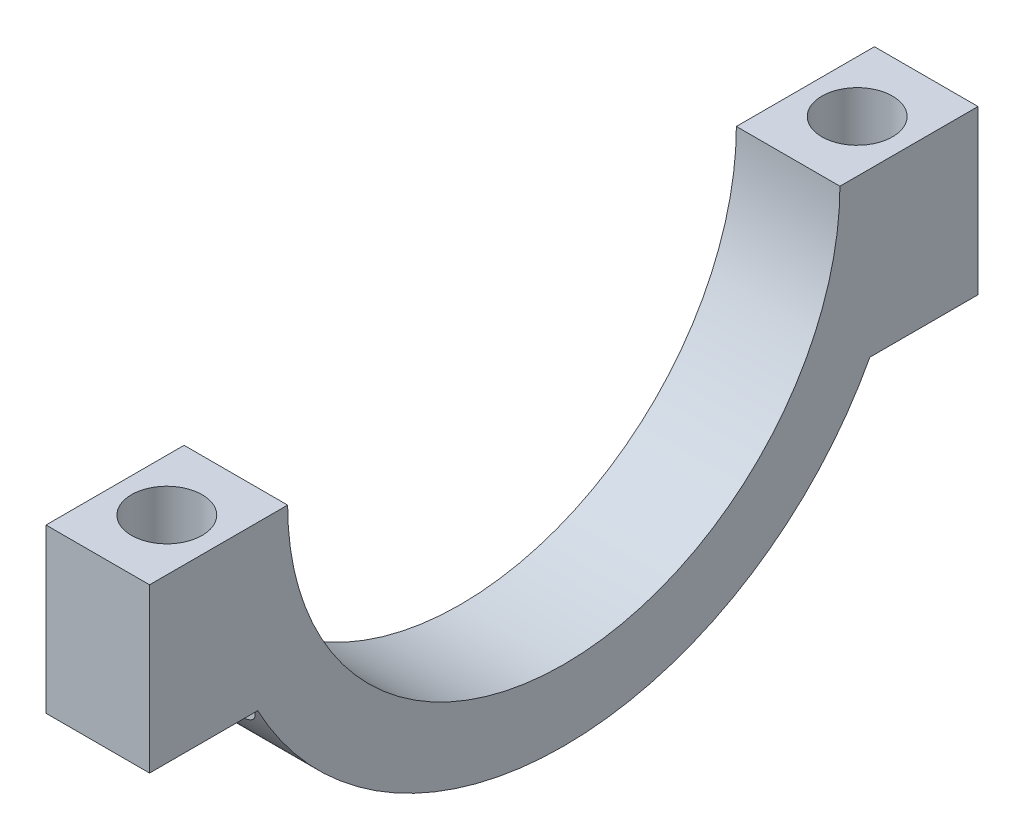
SolidWorks part; units mm, degrees
ref_plane "Front Plane" through (0, 0, 0) normal (0, 0, 1) x (1, 0, 0)
ref_plane "Top Plane" through (0, 0, 0) normal (0, 1, 0) x (1, 0, 0)
ref_plane "Right Plane" through (0, 0, 0) normal (1, 0, 0) x (0, 0, -1)
sketch "Sketch1" plane through (0, 0, 0) normal (1, 0, 0) x (0, 0, -1)
  line L0 (0, 0) -> (50.8, 0) construction
  line L1 (50.8, 0) -> (76.2, 0)
  line L2 (76.2, 0) -> (76.2, -30)
  line L3 (-50.8, 0) -> (-76.2, 0)
  line L4 (-76.2, 0) -> (-76.2, -30)
  line L5 (-76.2, -30) -> (-56.3067, -30)
  line L6 (56.3067, -30) -> (76.2, -30)
  line L7 (-63.5, 0) -> (-63.5, -26.1289) construction
  circle A0 centre (0, 0) radius 50.8 construction
  arc A1 (50.8, 0) -> (-50.8, 0) centre (0, 0) cw
  arc A2 (-56.3067, -30) -> (56.3067, -30) centre (0, 0) ccw
  dimension "D1" = 101.6
  dimension "D2" = 13
  dimension "D3" = 76.2
  dimension "D4" = 30
  dimension "D5" = 63.5
extrude "Boss-Extrude1" add sketch "Sketch1" along normal mid plane 19.05
sketch "Sketch2" plane through (0, 0, 0) normal (0, 1, 0) x (1, 0, 0)
  line L0 (0, -63.5) -> (0, 63.5) construction
  circle A0 centre (0, 63.5) radius 6.5
  circle A1 centre (0, -63.5) radius 6.5
  point P4 (0, 0)
  dimension "D2" = 13
  dimension "D3" = 13
  dimension "D1" = 127
extrude "Cut-Extrude1" cut sketch "Sketch2" against normal through all
sketch "Sketch3" plane through (0, -30, 0) normal (0, -1, 0) x (1, 0, 0)
  circle A0 centre (0, 63.5) radius 11.5
  circle A1 centre (0, -63.5) radius 11.5
  dimension "D1" = 23
extrude "Cut-Extrude2" cut sketch "Sketch3" along normal blind 19.05
